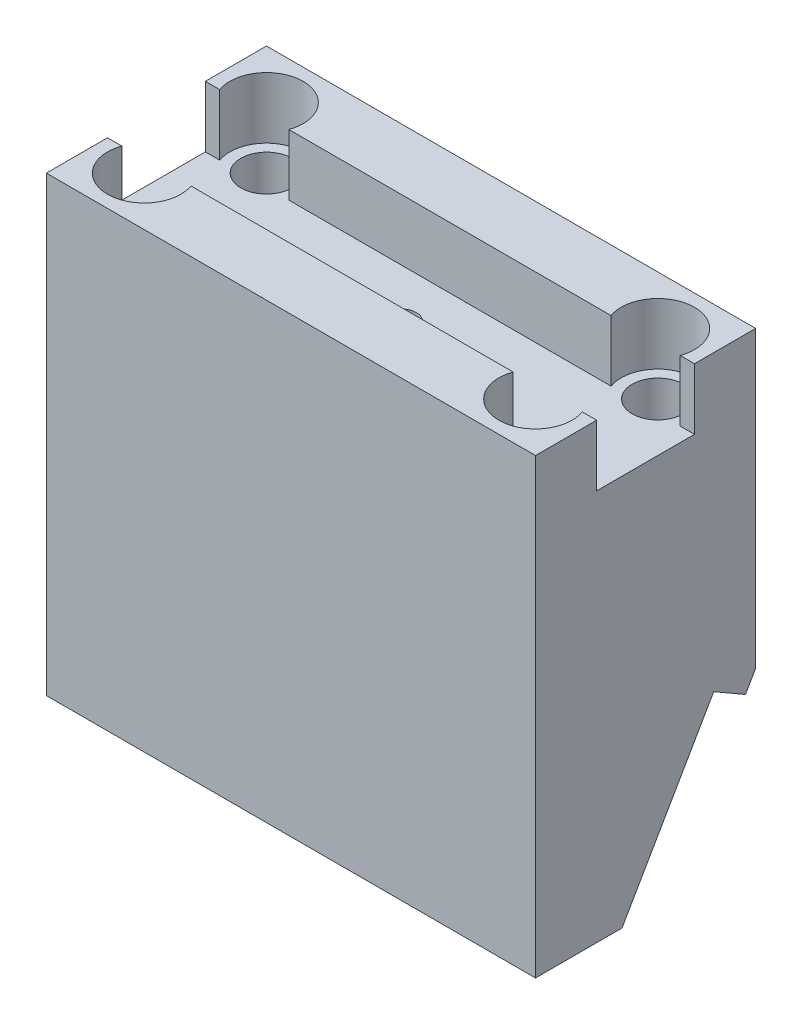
SolidWorks part; units mm, degrees
ref_plane "Plan de face" through (0, 0, 0) normal (0, 0, 1) x (1, 0, 0)
ref_plane "Plan de dessus" through (0, 0, 0) normal (0, 1, 0) x (1, 0, 0)
ref_plane "Plan de droite" through (0, 0, 0) normal (1, 0, 0) x (0, 0, -1)
sketch "Esquisse2" plane through (0, 0, 0) normal (1, 0, 0) x (0, 0, -1)
  line L0 (0, 0) -> (10.5359, 0)
  line L1 (18, 12.9282) -> (10.5359, 0)
  line L2 (18, 12.9282) -> (18, 37)
  line L3 (18, 37) -> (0, 37)
  line L4 (0, 37) -> (0, 0)
  line L5 (14, 27.5726) -> (14, 0.9469) construction
  line L6 (-16.2351, 6) -> (29.1106, 6) construction
  dimension "D1" = 37
  dimension "D2" = 18
  dimension "D3" = 30
  dimension "D4" = 14
  dimension "D5" = 31
extrude "Extrusion1" add sketch "Esquisse2" along normal blind 40
hole_wizard "Trou taraudé M51" positions "Esquisse3D1" profile "Esquisse3" tap size "M5" standard "ISO"
sketch3d "Esquisse3D1"
  line L0 (0, 37, -18) -> (0, 37, 0) construction
  line L1 (40, 37, 0) -> (0, 37, 0) construction
  point P0 (4, 37, -4)
  dimension "D1" = 4
  dimension "D2" = 4
sketch "Esquisse3" plane through (4, 37, -4) normal (1, 0, 0) x (0, 0, 1)
  line L0 (0, 0) -> (0, 16.6618)
  line L1 (0, 16.6618) -> (2.1, 15.4)
  line L2 (2.1, 15.4) -> (2.1, 0)
  line L5 (2.1, 0) -> (0, 0)
  line L10 (0, 16.6618) -> (-2.1, 15.4) construction
  line L11 (0, -6.35) -> (0, 107.95) construction
  dimension "Diamètre du trou pour taraudage" = 4.2
  dimension "Profondeur du trou pour taraudage" = 15.4
  dimension "Angle de pointe" = 118
sketch "Esquisse11" plane through (0, 37, 0) normal (0, 1, 0) x (-1, 0, 0)
  circle A0 centre (-4, -4) radius 3
  dimension "D1" = 6
extrude "Extrusion5" cut sketch "Esquisse11" against normal blind 5
pattern_linear "Répétition linéaire1" count 2 spacing 10 along (0, 0, -1) count 2 spacing 32 along (1, 0, 0) of "Trou taraudé M51", "Extrusion5"
sketch "Esquisse5" plane through (0, 37, 0) normal (0, 1, 0) x (1, 0, 0)
  line L0 (40, 18) -> (0, 18) construction
  line L1 (-12.2693, 13) -> (47.1469, 13)
  line L2 (-12.2693, 13) -> (-12.2693, 5)
  line L3 (-12.2693, 5) -> (47.1469, 5)
  line L4 (47.1469, 13) -> (47.1469, 5)
  dimension "D1" = 8
  dimension "D2" = 5
extrude "Extrusion2" cut sketch "Esquisse5" against normal blind 5
sketch "Esquisse6" plane through (0, 0, 0) normal (-1, 0, 0) x (0, 0, 1)
  line L0 (-10.5359, 0) -> (-18, 12.9282) construction
  line L1 (-14.5718, 12.9904) -> (-6.118, -1.652)
  line L2 (-14.5718, 12.9904) -> (-39.7779, -1.5624)
  line L3 (-39.7779, -1.5624) -> (-31.3241, -16.2047)
  line L4 (-6.118, -1.652) -> (-31.3241, -16.2047)
  dimension "D1" = 3
extrude "Extrusion3" cut sketch "Esquisse6" against normal through all
hole_wizard "Trou taraudé M32" positions "Esquisse3D3" profile "Esquisse7" tap size "M3" standard "ISO"
sketch3d "Esquisse3D3"
  line L0 (0, 0, -7.0718) -> (40, 0, -7.0718) construction
  line L1 (0, 12.9904, -14.5718) -> (0, 0, -7.0718) construction
  point P0 (10, 6.4952, -10.8218)
  point P2 (30, 6.4952, -10.8218)
  dimension "D1" = 7.5
  dimension "D2" = 20
  dimension "D3" = 10
  dimension "D4" = 7.5
sketch "Esquisse7" plane through (10, 6.4952, -10.8218) normal (1, 0, 0) x (0, 0.866, -0.5)
  line L0 (0, 0) -> (0, 8.2511)
  line L1 (0, 8.2511) -> (1.25, 7.5)
  line L2 (1.25, 7.5) -> (1.25, 0)
  line L5 (1.25, 0) -> (0, 0)
  line L10 (0, 8.2511) -> (-1.25, 7.5) construction
  line L11 (0, -6.35) -> (0, 107.95) construction
  dimension "Diamètre du trou pour taraudage" = 2.5
  dimension "Profondeur du trou pour taraudage" = 7.5
  dimension "Angle de pointe" = 118
hole_wizard "Trou taraudé M31" positions "Esquisse3D5" profile "Esquisse9" tap size "M3" standard "ISO"
sketch3d "Esquisse3D5"
  line L0 (0, 32, -13) -> (0, 32, -5) construction
  line L2 (37.8466, 32, -13) -> (5.8466, 32, -13) construction
  point P0 (20, 32, -9)
  dimension "D1" = 20
  dimension "D2" = 4
sketch "Esquisse9" plane through (20, 32, -9) normal (1, 0, 0) x (0, 0, 1)
  line L0 (0, 0) -> (0, 13.7511)
  line L1 (0, 13.7511) -> (1.25, 13)
  line L2 (1.25, 13) -> (1.25, 0)
  line L5 (1.25, 0) -> (0, 0)
  line L10 (0, 13.7511) -> (-1.25, 13) construction
  line L11 (0, -6.35) -> (0, 107.95) construction
  dimension "Diamètre du trou pour taraudage" = 2.5
  dimension "Profondeur du trou pour taraudage" = 13
  dimension "Angle de pointe" = 118
